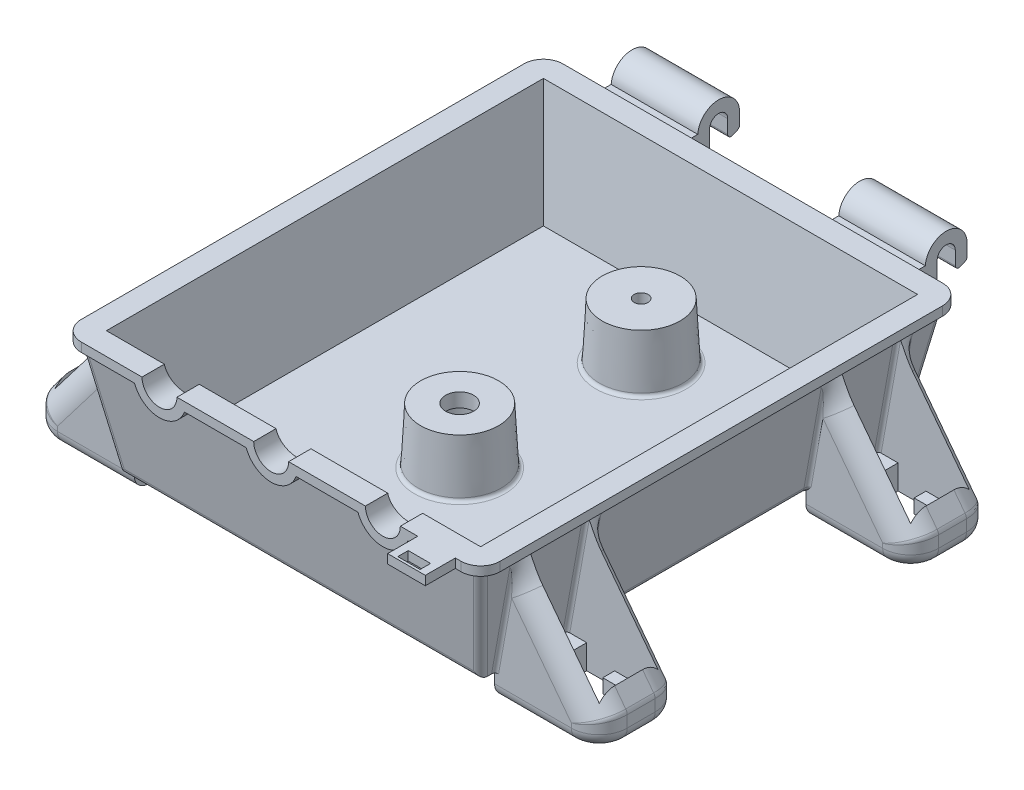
SolidWorks part; units mm, degrees
ref_plane "Front Plane" through (0, 0, 0) normal (0, 0, 1) x (1, 0, 0)
ref_plane "Top Plane" through (0, 0, 0) normal (0, 1, 0) x (1, 0, 0)
ref_plane "Right Plane" through (0, 0, 0) normal (1, 0, 0) x (0, 0, -1)
sketch "Sketch1" plane through (0, 0, 0) normal (0, 1, 0) x (1, 0, 0)
  line L1 (-36.576, 42.291) -> (36.576, 42.291)
  line L2 (-36.576, 42.291) -> (-36.576, -42.291)
  line L3 (-36.576, -42.291) -> (36.576, -42.291)
  line L4 (36.576, 42.291) -> (36.576, -42.291)
  line L5 (-36.576, 42.291) -> (36.576, -42.291) construction
  line L6 (-36.576, -42.291) -> (36.576, 42.291) construction
  point P0 (0, 0)
extrude "Boss-Extrude1" add sketch "Sketch1" along normal blind 20.574
sketch "Sketch10" plane through (0, 20.574, 0) normal (0, 1, 0) x (1, 0, 0)
  line L1 (-38.1, -43.815) -> (38.1, -43.815)
  line L2 (-38.1, -43.815) -> (-38.1, 43.815)
  line L3 (-38.1, 43.815) -> (38.1, 43.815)
  line L4 (38.1, -43.815) -> (38.1, 43.815)
  line L5 (-38.1, -43.815) -> (38.1, 43.815) construction
  line L6 (-38.1, 43.815) -> (38.1, -43.815) construction
  point P0 (0, 0)
extrude "Boss-Extrude3" add sketch "Sketch10" along normal blind 1.651
sketch "Sketch11" plane through (0, 0, -42.291) normal (0, 0, -1) x (-1, 0, 0)
  line L0 (0, 20.574) -> (12.827, 20.574) construction
  line L1 (-36.576, 20.574) -> (36.576, 20.574) construction
  line L2 (0, 20.574) -> (-12.827, 20.574) construction
  line L3 (12.827, 20.574) -> (12.827, 24.13)
  line L4 (12.827, 24.13) -> (28.575, 24.13)
  line L5 (28.575, 24.13) -> (28.575, 12.7)
  line L6 (28.575, 12.7) -> (12.827, 12.7)
  line L7 (12.827, 12.7) -> (12.827, 20.574)
  line L8 (-12.827, 20.574) -> (-12.827, 24.13)
  line L9 (-12.827, 24.13) -> (-28.575, 24.13)
  line L10 (-28.575, 24.13) -> (-28.575, 12.7)
  line L11 (-28.575, 12.7) -> (-12.827, 12.7)
  line L12 (-12.827, 12.7) -> (-12.827, 20.574)
extrude "Boss-Extrude4" add sketch "Sketch11" along normal blind 11.938
sketch "Sketch12" plane through (28.575, 0, 0) normal (1, 0, 0) x (0, 0, -1)
  line L0 (43.815, 20.574) -> (46.6175, 20.574)
  line L2 (43.815, 20.574) -> (43.815, 22.225)
  line L4 (43.815, 22.225) -> (42.291, 22.225)
  line L5 (42.291, 22.225) -> (42.291, 24.13)
  line L6 (42.291, 24.13) -> (50.419, 24.13)
  arc A0 (50.419, 24.13) -> (46.6175, 20.574) centre (50.419, 20.32) ccw
extrude "Cut-Extrude1" cut sketch "Sketch12" against normal through all
sketch "Sketch13" plane through (28.575, 0, 0) normal (1, 0, 0) x (0, 0, -1)
  line L0 (50.419, 24.13) -> (54.229, 24.13)
  line L1 (54.229, 24.13) -> (54.229, 20.32)
  arc A0 (54.229, 20.32) -> (50.419, 24.13) centre (50.419, 20.32) ccw
extrude "Cut-Extrude2" cut sketch "Sketch13" against normal through all
sketch "Sketch14" plane through (28.575, 0, 0) normal (1, 0, 0) x (0, 0, -1)
  line L0 (42.291, 12.7) -> (54.229, 17.8056)
  line L1 (42.291, 20.574) -> (42.291, 12.7) construction
  line L2 (42.291, 20.574) -> (42.291, 0) construction
  line L3 (54.229, 20.32) -> (54.229, 12.7) construction
  line L4 (54.229, 17.8056) -> (54.229, 12.7)
  line L5 (54.229, 12.7) -> (42.291, 12.7)
extrude "Cut-Extrude3" cut sketch "Sketch14" against normal through all
sketch "Sketch15" plane through (28.575, 0, 0) normal (1, 0, 0) x (0, 0, -1)
  line L0 (52.07, 20.32) -> (52.07, 16.8823)
  line L1 (54.229, 17.8056) -> (42.291, 12.7) construction
  line L2 (52.07, 16.8823) -> (48.768, 15.4701)
  line L3 (48.768, 15.4701) -> (48.768, 20.32)
  arc A0 (52.07, 20.32) -> (48.768, 20.32) centre (50.419, 20.32) ccw
extrude "Cut-Extrude4" cut sketch "Sketch15" against normal through all
fillet "Fillet1" radius 3.556 4 edges at (-38.1, 21.3995, -43.815) (38.1, 21.3995, -43.815) (38.1, 21.3995, 43.815) (-38.1, 21.3995, 43.815)
fillet "Fillet2" radius 0.635 6 edges at (20.701, 16.8823, -52.07) (20.701, 17.8056, -54.229) (-20.701, 17.8056, -54.229) (-20.701, 16.8823, -52.07) (-20.701, 15.4701, -48.768) (20.701, 15.4701, -48.768)
sketch "Sketch16" plane through (0, 22.225, 0) normal (0, 1, 0) x (1, 0, 0)
  line L1 (-34.036, -39.751) -> (34.036, -39.751)
  line L2 (-34.036, -39.751) -> (-34.036, 39.751)
  line L3 (-34.036, 39.751) -> (34.036, 39.751)
  line L4 (34.036, -39.751) -> (34.036, 39.751)
  line L5 (-34.036, -39.751) -> (34.036, 39.751) construction
  line L6 (-34.036, 39.751) -> (34.036, -39.751) construction
  point P0 (0, 0)
extrude "Cut-Extrude5" cut sketch "Sketch16" against normal blind 19.685 draft 10.25
sketch "Sketch17" plane through (0, 0, 43.815) normal (0, 0, 1) x (1, 0, 0)
  line L0 (-34.544, 22.225) -> (34.544, 22.225) construction
  line L1 (-25.146, 22.225) -> (-15.494, 22.225)
  line L2 (-4.826, 22.225) -> (4.826, 22.225)
  line L3 (15.494, 22.225) -> (25.146, 22.225)
  arc A0 (-4.826, 22.225) -> (4.826, 22.225) centre (0, 22.225) ccw
  arc A1 (15.494, 22.225) -> (25.146, 22.225) centre (20.32, 22.225) ccw
  arc A2 (-25.146, 22.225) -> (-15.494, 22.225) centre (-20.32, 22.225) ccw
extrude "Boss-Extrude5" add sketch "Sketch17" against normal blind 2.54
sketch "Sketch18" plane through (0, 0, 43.815) normal (0, 0, 1) x (1, 0, 0)
  line L0 (-34.544, 22.225) -> (34.544, 22.225) construction
  circle A0 centre (-20.32, 22.225) radius 3.175
  circle A1 centre (0, 22.225) radius 3.175
  circle A2 centre (20.32, 22.225) radius 3.175
extrude "Cut-Extrude6" cut sketch "Sketch18" against normal blind 6.35
sketch "Sketch19" plane through (0, 20.574, 0) normal (0, -1, 0) x (1, 0, 0)
  line L1 (24.8548, 43.815) -> (34.544, 43.815) construction
  line L2 (26.6638, 43.815) -> (26.6638, 49.2836)
  line L3 (26.6638, 49.2836) -> (33.5116, 49.2836)
  line L4 (33.5116, 49.2836) -> (33.5116, 43.815)
  line L5 (33.5116, 43.815) -> (26.6638, 43.815)
extrude "Boss-Extrude6" add sketch "Sketch19" against normal blind 1.651
sketch "Sketch20" plane through (0, 20.574, 0) normal (0, -1, 0) x (1, 0, 0)
  line L4 (28.0557, 46.9341) -> (32.1197, 46.9341)
  line L5 (28.0557, 46.9341) -> (28.0557, 48.8391)
  line L6 (28.0557, 48.8391) -> (32.1197, 48.8391)
  line L7 (32.1197, 46.9341) -> (32.1197, 48.8391)
  line L8 (28.0557, 46.9341) -> (32.1197, 48.8391) construction
  line L9 (28.0557, 48.8391) -> (32.1197, 46.9341) construction
extrude "Cut-Extrude7" cut sketch "Sketch20" against normal through all
sketch "Sketch21" plane through (0, 2.54, 0) normal (0, 1, 0) x (1, 0, 0)
  line L0 (0, 36.1914) -> (0, 23.4914) construction
  line L1 (30.4764, 36.1914) -> (-30.4764, 36.1914) construction
  line L2 (0, -36.1914) -> (0, -9.5214) construction
  line L3 (-30.4764, -36.1914) -> (30.4764, -36.1914) construction
  circle A0 centre (0, 23.4914) radius 7.62
  circle A1 centre (0, -9.5214) radius 7.62
extrude "Boss-Extrude7" add sketch "Sketch21" along normal blind 10.16
draft "Draft23" type of draft neutral plane draft angle 3 faces to draft 2 parameters "D1"=3
sketch "Sketch23" plane through (0, 0, 0) normal (0, -1, 0) x (1, 0, 0)
  line L1 (-22.86, 15.875) -> (22.86, 15.875)
  line L2 (-22.86, 15.875) -> (-22.86, -15.875)
  line L3 (-22.86, -15.875) -> (22.86, -15.875)
  line L4 (22.86, 15.875) -> (22.86, -15.875)
  line L5 (-22.86, 15.875) -> (22.86, -15.875) construction
  line L6 (-22.86, -15.875) -> (22.86, 15.875) construction
  point P0 (0, 0)
extrude "Boss-Extrude8" add sketch "Sketch23" along normal blind 3.81
sketch "Sketch24" plane through (0, -3.81, 0) normal (0, -1, 0) x (1, 0, 0)
  line L0 (22.86, 15.875) -> (-22.86, 15.875) construction
  line L1 (-15.875, -15.875) -> (15.875, -15.875)
  line L2 (-15.875, -15.875) -> (-15.875, 15.875)
  line L3 (-15.875, 15.875) -> (15.875, 15.875)
  line L4 (15.875, -15.875) -> (15.875, 15.875)
  line L5 (-15.875, -15.875) -> (15.875, 15.875) construction
  line L6 (-15.875, 15.875) -> (15.875, -15.875) construction
  point P0 (0, 0)
extrude "Cut-Extrude8" cut sketch "Sketch24" against normal blind 3.81
fillet "Fillet3" radius 2.032 4 edges at (15.875, -3.81, 0) (-15.875, -3.81, 0) (-22.86, -3.81, 0) (22.86, -3.81, 0)
sketch "Sketch33" plane through (0, 0, 0) normal (0, -1, 0) x (1, 0, 0)
  line L0 (36.576, 35.941) -> (51.816, 35.941)
  line L1 (-36.576, -42.291) -> (-36.576, 42.291) construction
  line L2 (-36.576, 35.941) -> (-36.576, 20.701)
  line L4 (-36.576, 20.701) -> (-51.816, 20.701)
  line L5 (-36.576, -42.291) -> (-36.576, 42.291) construction
  line L6 (-51.816, 20.701) -> (-51.816, 35.941)
  line L7 (-51.816, 35.941) -> (-36.576, 35.941)
  line L8 (-36.576, -35.941) -> (-51.816, -35.941)
  line L9 (-51.816, -35.941) -> (-51.816, -20.701)
  line L10 (-51.816, -20.701) -> (-36.576, -20.701)
  line L11 (-36.576, -20.701) -> (-36.576, -35.941)
  line L12 (36.576, 42.291) -> (36.576, -42.291) construction
  line L13 (51.816, 35.941) -> (51.816, 20.701)
  line L14 (51.816, 20.701) -> (36.576, 20.701)
  line L15 (36.576, 20.701) -> (36.576, 35.941)
  line L16 (36.576, -20.701) -> (51.816, -20.701)
  line L17 (51.816, -20.701) -> (51.816, -35.941)
  line L18 (51.816, -35.941) -> (36.576, -35.941)
  line L19 (36.576, -35.941) -> (36.576, -20.701)
extrude "Boss-Extrude10" add sketch "Sketch33" against normal up to surface (20.574 mm away)
sketch "Sketch34" plane through (0, 0, 35.941) normal (0, 0, 1) x (1, 0, 0)
  line L5 (-36.576, 20.574) -> (-51.816, 20.574)
  line L10 (-51.816, 20.574) -> (-51.816, 0) construction
  line L11 (-51.816, 0.635) -> (-51.816, 20.574)
  line L12 (-36.576, 20.574) -> (-51.816, 0.635)
extrude "Cut-Extrude12" cut sketch "Sketch34" against normal through all
sketch "Sketch35" plane through (0, 0, 35.941) normal (0, 0, 1) x (1, 0, 0)
  line L3 (36.576, 20.574) -> (51.816, 20.574)
  line L5 (51.816, 20.574) -> (51.816, 0) construction
  line L6 (51.816, 0.635) -> (51.816, 20.574)
  line L7 (36.576, 20.574) -> (51.816, 0.635)
extrude "Cut-Extrude13" cut sketch "Sketch35" against normal through all
sketch "Sketch36" plane through (0, 0, 0) normal (0, -1, 0) x (1, 0, 0)
  line L0 (-51.816, 35.941) -> (-36.576, 35.941)
  line L1 (-36.576, 35.941) -> (-36.576, 20.701)
  line L2 (-36.576, 20.701) -> (-51.816, 20.701)
  line L3 (-51.816, 20.701) -> (-51.816, 35.941)
  line L4 (36.576, 35.941) -> (51.816, 35.941)
  line L5 (51.816, 35.941) -> (51.816, 20.701)
  line L6 (51.816, 20.701) -> (36.576, 20.701)
  line L7 (36.576, 20.701) -> (36.576, 35.941)
  line L8 (36.576, -20.701) -> (51.816, -20.701)
  line L9 (51.816, -20.701) -> (51.816, -35.941)
  line L10 (51.816, -35.941) -> (36.576, -35.941)
  line L11 (36.576, -35.941) -> (36.576, -20.701)
  line L12 (-36.576, -20.701) -> (-36.576, -35.941)
  line L13 (-36.576, -35.941) -> (-51.816, -35.941)
  line L14 (-51.816, -35.941) -> (-51.816, -20.701)
  line L15 (-51.816, -20.701) -> (-36.576, -20.701)
extrude "Boss-Extrude11" add sketch "Sketch36" along normal blind 4.445
sketch "Sketch37" plane through (0, -4.445, 0) normal (0, -1, 0) x (1, 0, 0)
  line L0 (-44.196, 31.496) -> (-36.576, 31.496)
  line L2 (-36.576, 20.701) -> (-36.576, 35.941) construction
  line L3 (-36.576, 31.496) -> (-36.576, 25.146)
  line L4 (-36.576, 20.701) -> (-36.576, 35.941) construction
  line L5 (-36.576, 25.146) -> (-44.196, 25.146)
  line L6 (-44.196, -25.146) -> (-36.576, -25.146)
  line L8 (-36.576, -35.941) -> (-36.576, -20.701) construction
  line L9 (-36.576, -25.146) -> (-36.576, -31.496)
  line L10 (-36.576, -31.496) -> (-44.196, -31.496)
  line L11 (44.196, 31.496) -> (36.576, 31.496)
  line L13 (36.576, 35.941) -> (36.576, 20.701) construction
  line L14 (36.576, 31.496) -> (36.576, 25.146)
  line L15 (36.576, 35.941) -> (36.576, 20.701) construction
  line L16 (36.576, 25.146) -> (44.196, 25.146)
  line L19 (44.196, -25.146) -> (36.576, -25.146)
  line L20 (36.576, -20.701) -> (36.576, -35.941) construction
  line L21 (36.576, -25.146) -> (36.576, -31.496)
  line L22 (36.576, -31.496) -> (44.196, -31.496)
  arc A0 (-44.196, 31.496) -> (-44.196, 25.146) centre (-44.196, 28.321) ccw
  arc A1 (-44.196, -25.146) -> (-44.196, -31.496) centre (-44.196, -28.321) ccw
  arc A2 (44.196, 25.146) -> (44.196, 31.496) centre (44.196, 28.321) ccw
  arc A3 (44.196, -31.496) -> (44.196, -25.146) centre (44.196, -28.321) ccw
extrude "Cut-Extrude14" cut sketch "Sketch37" against normal up to surface (25.019 mm away)
sketch "Sketch41" plane through (0, 20.574, 0) normal (0, -1, 0) x (1, 0, 0)
  line L7 (-49.53, 33.655) -> (-49.53, 22.987)
  line L12 (-49.53, -22.987) -> (-49.53, -33.655)
  line L13 (-49.53, -22.987) -> (-36.576, -22.987)
  line L15 (-49.53, -33.655) -> (-36.576, -33.655)
  line L16 (-36.576, -33.655) -> (-36.576, -22.987)
  line L17 (-49.53, 33.655) -> (-36.576, 33.655)
  line L18 (-49.53, 22.987) -> (-36.576, 22.987)
  line L19 (-36.576, 22.987) -> (-36.576, 33.655)
  line L22 (49.53, 22.987) -> (49.53, 33.655)
  line L23 (49.53, 33.655) -> (36.576, 33.655)
  line L24 (49.53, 22.987) -> (36.576, 22.987)
  line L25 (36.576, 22.987) -> (36.576, 33.655)
  line L27 (49.53, -33.655) -> (49.53, -22.987)
  line L28 (49.53, -22.987) -> (36.576, -22.987)
  line L29 (49.53, -33.655) -> (36.576, -33.655)
  line L30 (36.576, -33.655) -> (36.576, -22.987)
extrude "Cut-Extrude15" cut sketch "Sketch41" along normal blind 22.479
sketch "Sketch42" plane through (0, -4.445, 0) normal (0, -1, 0) x (1, 0, 0)
  line L1 (-36.576, 31.496) -> (-36.576, 35.941) construction
  line L2 (-36.576, 33.655) -> (-41.656, 33.655)
  line L3 (-41.656, 33.655) -> (-41.656, 31.496)
  line L4 (-36.576, 31.496) -> (-44.196, 31.496) construction
  line L5 (-41.656, 31.496) -> (-36.576, 31.496)
  line L6 (-36.576, 31.496) -> (-36.576, 33.655)
  line L7 (-36.576, 20.701) -> (-36.576, 25.146) construction
  line L8 (-36.576, 22.987) -> (-41.656, 22.987)
  line L9 (-41.656, 22.987) -> (-41.656, 25.146)
  line L10 (-44.196, 25.146) -> (-36.576, 25.146) construction
  line L11 (-41.656, 25.146) -> (-36.576, 25.146)
  line L12 (-36.576, 22.987) -> (-36.576, 33.655) construction
  line L13 (-36.576, 22.987) -> (-36.576, 33.655) construction
  line L14 (-36.576, 25.146) -> (-36.576, 22.987)
  line L16 (-36.576, -22.987) -> (-41.656, -22.987)
  line L17 (-36.576, -25.146) -> (-36.576, -20.701) construction
  line L18 (-41.656, -22.987) -> (-41.656, -25.146)
  line L19 (-36.576, -25.146) -> (-44.196, -25.146) construction
  line L20 (-41.656, -25.146) -> (-36.576, -25.146)
  line L21 (-36.576, -33.655) -> (-36.576, -22.987) construction
  line L22 (-36.576, -25.146) -> (-36.576, -22.987)
  line L23 (-36.576, -35.941) -> (-36.576, -31.496) construction
  line L24 (-36.576, -33.655) -> (-41.656, -33.655)
  line L25 (-41.656, -33.655) -> (-41.656, -31.496)
  line L26 (-44.196, -31.496) -> (-36.576, -31.496) construction
  line L27 (-41.656, -31.496) -> (-36.576, -31.496)
  line L28 (-36.576, -33.655) -> (-36.576, -22.987) construction
  line L29 (-36.576, -31.496) -> (-36.576, -33.655)
  line L30 (36.576, -22.987) -> (36.576, -33.655) construction
  line L31 (36.576, -22.987) -> (41.656, -22.987)
  line L32 (41.656, -22.987) -> (41.656, -25.146)
  line L33 (44.196, -25.146) -> (36.576, -25.146) construction
  line L34 (41.656, -25.146) -> (36.576, -25.146)
  line L35 (36.576, -25.146) -> (36.576, -22.987)
  line L36 (36.576, -33.655) -> (41.656, -33.655)
  line L37 (41.656, -33.655) -> (41.656, -31.496)
  line L38 (36.576, -31.496) -> (44.196, -31.496) construction
  line L39 (41.656, -31.496) -> (36.576, -31.496)
  line L40 (36.576, -31.496) -> (36.576, -33.655)
  line L41 (36.576, 35.941) -> (36.576, 31.496) construction
  line L42 (36.576, 33.655) -> (41.656, 33.655)
  line L43 (41.656, 33.655) -> (41.656, 31.496)
  line L44 (44.196, 31.496) -> (36.576, 31.496) construction
  line L45 (41.656, 31.496) -> (36.576, 31.496)
  line L46 (36.576, 31.496) -> (36.576, 33.655)
  line L47 (36.576, 33.655) -> (36.576, 22.987) construction
  line L48 (36.576, 22.987) -> (41.656, 22.987)
  line L49 (41.656, 22.987) -> (41.656, 25.146)
  line L50 (36.576, 25.146) -> (44.196, 25.146) construction
  line L51 (41.656, 25.146) -> (36.576, 25.146)
  line L52 (36.576, 25.146) -> (36.576, 22.987)
extrude "Cut-Extrude16" cut sketch "Sketch42" against normal up to surface (2.54 mm away)
draft "Draft25" type of draft neutral plane draft angle 10.25 faces to draft 12 parameters "D1"=10.25
fillet "Fillet4" radius 1.27 12 edges at (51.816, 0.635, -28.321) (51.816, 0.635, 28.321) (-51.816, 0.635, 28.321) (-51.816, 0.635, -28.321) (36.576, 0, -34.798) (36.576, 0, -21.844) (36.576, 0, 21.844) (36.576, 0, 34.798) (-36.576, 0, 21.844) (-36.576, 0, 34.798) (-36.576, 0, -21.844) (-36.576, 0, -34.798)
fillet "Fillet5" radius 0.635 16 edges at (34.7158, 10.287, 20.701) (34.7158, 10.287, 35.941) (-34.7158, 10.287, 35.941) (-34.7158, 10.287, 20.701) (-34.7158, 10.287, -20.701) (-34.7158, 10.287, -35.941) (34.7158, 10.287, -35.941) (34.7158, 10.287, -20.701) (34.7158, 10.287, 22.987) (34.7158, 10.287, 33.655) (34.7158, 10.287, -33.655) (34.7158, 10.287, -22.987) (-34.7158, 10.287, -22.987) (-34.7158, 10.287, -33.655) (-34.7158, 10.287, 33.655) (-34.7158, 10.287, 22.987)
fillet "Fillet6" radius 0.635 2 edges at (0, 2.54, 1.9014) (0, 2.54, -31.1114)
fillet "Fillet7" radius 0.635 6 edges at (-12.827, 16.307, -41.5194) (28.575, 16.307, -41.5194) (-28.575, 16.307, -41.5194) (-20.701, 12.04, -40.7478) (20.701, 12.04, -40.7478) (12.827, 16.307, -41.5194)
sketch "Sketch48" plane through (0, 0, 0) normal (0, -1, 0) x (1, 0, 0)
  line L2 (-35.306, 35.941) -> (-32.766, 35.941)
  line L3 (-32.766, 35.941) -> (-32.766, 20.701)
  line L5 (-32.766, 20.701) -> (-36.576, 20.701)
  line L6 (-36.576, 20.701) -> (-36.576, 35.941)
  line L7 (-36.576, 35.941) -> (-35.306, 35.941)
extrude "Boss-Extrude21" add sketch "Sketch48" along normal up to surface (4.445 mm away)
sketch "Sketch49" plane through (0, 0, 0) normal (0, -1, 0) x (1, 0, 0)
  line L0 (-32.766, -20.701) -> (-36.576, -20.701)
  line L1 (-36.576, -20.701) -> (-36.576, -35.941)
  line L2 (-37.0978, -35.941) -> (-33.5009, -35.941) construction
  line L3 (-36.576, -35.941) -> (-35.306, -35.941) construction
  line L4 (-36.576, -35.941) -> (-32.766, -35.941)
  line L5 (-32.766, -35.941) -> (-32.766, -20.701)
extrude "Boss-Extrude23" add sketch "Sketch49" along normal blind 4.445
sketch "Sketch50" plane through (0, 0, 0) normal (0, -1, 0) x (1, 0, 0)
  line L0 (36.576, 35.941) -> (32.766, 35.941)
  line L1 (32.766, 35.941) -> (32.766, 20.701)
  line L2 (32.766, 20.701) -> (36.576, 20.701)
  line L3 (36.576, 20.701) -> (36.576, 35.941)
  line L4 (36.576, -20.701) -> (32.766, -20.701)
  line L5 (32.766, -20.701) -> (32.766, -35.941)
  line L6 (32.766, -35.941) -> (36.576, -35.941)
  line L7 (36.576, -35.941) -> (36.576, -20.701)
extrude "Boss-Extrude24" add sketch "Sketch50" along normal blind 4.445
fillet "Fillet8" radius 5.08 32 edges at (36.7288, 20.374, 36.127) (44.3264, 10.4339, 35.941) (51.749, 0.6123, 35.941) (51.816, -2.1199, 35.941) (-36.7288, 20.374, 36.127) (-44.3264, 10.4339, 35.941) (-51.749, 0.6123, 35.941) (-36.7288, 20.374, 20.515) (-44.3264, 10.4339, 20.701) (-51.749, 0.6123, 20.701) (-36.7288, 20.374, -20.515) (-44.3264, 10.4339, -20.701) (-51.749, 0.6123, -20.701) (-36.7288, 20.374, -36.127) (-44.3264, 10.4339, -35.941) (-51.749, 0.6123, -35.941) (36.7288, 20.374, -36.127) (44.3264, 10.4339, -35.941) (51.749, 0.6123, -35.941) (36.7288, 20.374, -20.515) (44.3264, 10.4339, -20.701) (51.749, 0.6123, -20.701) (36.7288, 20.374, 20.515) (44.3264, 10.4339, 20.701) (51.749, 0.6123, 20.701) (-51.816, -2.1199, 35.941) (-51.816, -2.1199, 20.701) (-51.816, -2.1199, -20.701) (-51.816, -2.1199, -35.941) (51.816, -2.1199, -35.941) (51.816, -2.1199, -20.701) (51.816, -2.1199, 20.701)
fillet "Fillet11" radius 2.54 20 edges at (39.751, -4.445, 20.701) (50.3281, -4.445, 22.1889) (51.816, -4.445, 28.321) (50.3281, -4.445, 34.4531) (39.751, -4.445, 35.941) (-39.751, -4.445, 35.941) (-50.3281, -4.445, 34.4531) (-51.816, -4.445, 28.321) (-50.3281, -4.445, 22.1889) (-39.751, -4.445, -20.701) (-50.3281, -4.445, -22.1889) (-51.816, -4.445, -28.321) (-50.3281, -4.445, -34.4531) (39.751, -4.445, -35.941) (50.3281, -4.445, -34.4531) (51.816, -4.445, -28.321) (50.3281, -4.445, -22.1889) (-39.751, -4.445, 20.701) (-39.751, -4.445, -35.941) (39.751, -4.445, -20.701)
fillet "Fillet12" radius 1.27 12 edges at (33.0446, 0, 20.515) (33.0446, 0, -20.515) (-33.0446, 0, -20.515) (-33.0446, 0, 20.515) (34.7158, 10.287, 40.4308) (-34.7158, 10.287, 40.4308) (-34.7158, 10.287, -40.4308) (34.7158, 10.287, -40.4308) (0, 0, 38.5706) (32.8556, 0, 0) (-32.8556, 0, 0) (0, 0, -38.5706)
sketch "Sketch51" plane through (0, 12.7, 0) normal (0, 1, 0) x (1, 0, 0)
  circle A0 centre (0, -9.5214) radius 2.54
extrude "Cut-Extrude17" cut sketch "Sketch51" against normal through all
sketch "Sketch52" plane through (0, 12.7, 0) normal (0, 1, 0) x (1, 0, 0)
  circle A0 centre (0, 23.4914) radius 1.27
extrude "Cut-Extrude18" cut sketch "Sketch52" against normal blind 6.35
sketch "Sketch56" plane through (0, 0, 0) normal (0, -1, 0) x (1, 0, 0)
  circle A0 centre (0, 9.5214) radius 5.08
extrude "Cut-Extrude20" cut sketch "Sketch56" against normal blind 10.16
